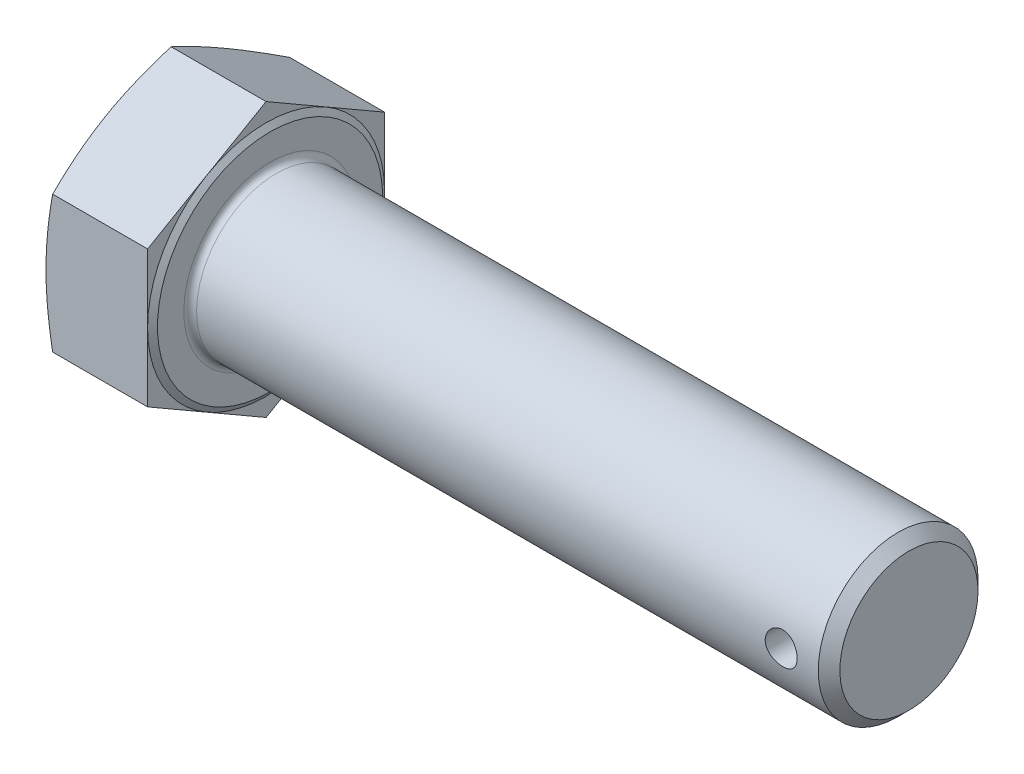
SolidWorks part; units mm, degrees
ref_plane "Front" through (0, 0, 0) normal (0, 0, 1) x (1, 0, 0)
ref_plane "Top" through (0, 0, 0) normal (0, 1, 0) x (1, 0, 0)
ref_plane "Right" through (0, 0, 0) normal (1, 0, 0) x (0, 0, -1)
sketch "Sketch-BaseHead" plane through (0, 0, 0) normal (1, 0, 0) x (0, 0, -1)
  line L1 (0, -17.13) -> (14.835, -8.565)
  line L2 (14.835, -8.565) -> (14.835, 8.565)
  line L3 (14.835, 8.565) -> (0, 17.13)
  line L4 (0, 17.13) -> (-14.835, 8.565)
  line L5 (-14.835, 8.565) -> (-14.835, -8.565)
  line L6 (-14.835, -8.565) -> (0, -17.13)
  circle A0 centre (0, 0) radius 14.835 construction
  dimension "s" = 29.67
extrude "BaseHead" add sketch "Sketch-BaseHead" along normal blind 12.72
sketch "Sketch4" plane through (-0.2646, -5.9169, 0) normal (0, 0, 1) x (0, 1, 0)
  line L0 (5.9169, 3.7369) -> (5.9169, -10.4477) construction
  line L2 (23.0469, -0.2646) -> (20.7519, -0.2646)
  line L4 (20.7519, -0.2646) -> (23.0469, -1.0999)
  line L6 (23.0469, -1.0999) -> (23.0469, -0.2646)
  dimension "D1" = 20
  dimension "D2" = 29.67
revolve "HeadChamfer" cut sketch "Sketch4" angle 360 about L0
sketch "Sketch1" plane through (0, 0, 0) normal (0, 1, 0) x (1, 0, 0)
  line L0 (12.72, 0) -> (13.22, 0)
  line L1 (13.22, 0) -> (13.22, 14.095)
  line L2 (13.22, 14.095) -> (12.72, 14.835)
  line L3 (12.72, 14.835) -> (12.72, 0)
  line L6 (-4.0016, 0) -> (10.1831, 0) construction
  dimension "D1" = 14.835
  dimension "D2" = 14.095
  dimension "D3" = 0.5
revolve "Revolve1" add sketch "Sketch1" angle 360 about axis through (-4.0016, 0, 0) along (1, 0, 0)
ref_plane "Plane2" through (47.22, 0, 0) normal (1, 0, 0) x (0, 0, -1)
sketch "Sketch3" plane through (13.22, 0, 0) normal (1, 0, 0) x (0, 0, -1)
  circle A0 centre (0, 0) radius 10
  dimension "d" = 20
extrude "BaseBody" add sketch "Sketch3" along normal blind 80
chamfer "Chamfer1" distance 1.353 angle 45 1 edges at (93.22, 10, 0)
fillet "HeadFillet" radius 0.8 1 edges at (13.22, -10, 0)
sketch "Sketch5" plane through (0, 0, 0) normal (0, 0, 1) x (1, 0, 0)
  line L2 (13.22, -14.095) -> (13.22, 14.095) construction
  line L3 (91.867, 0) -> (14.02, 0) construction
  circle A0 centre (87.22, 0) radius 2
  dimension "d1" = 4
  dimension "lh" = 74
extrude "Hole" cut sketch "Sketch5" against normal through all and the other way through all
equation "\"D1@Sketch1\" = \"s@Sketch-BaseHead\" / 2"
equation "\"D2@Sketch4\" = \"s@Sketch-BaseHead\""
equation "\"D1@Chamfer1\" = (  \"d@Sketch3\"  -\"D2@ThreadCosmetic1\" ) / 2 "
equation "\"b@ThreadCosmetic1\" = \"l@BaseBody\" - \"lg@Plane2\""
